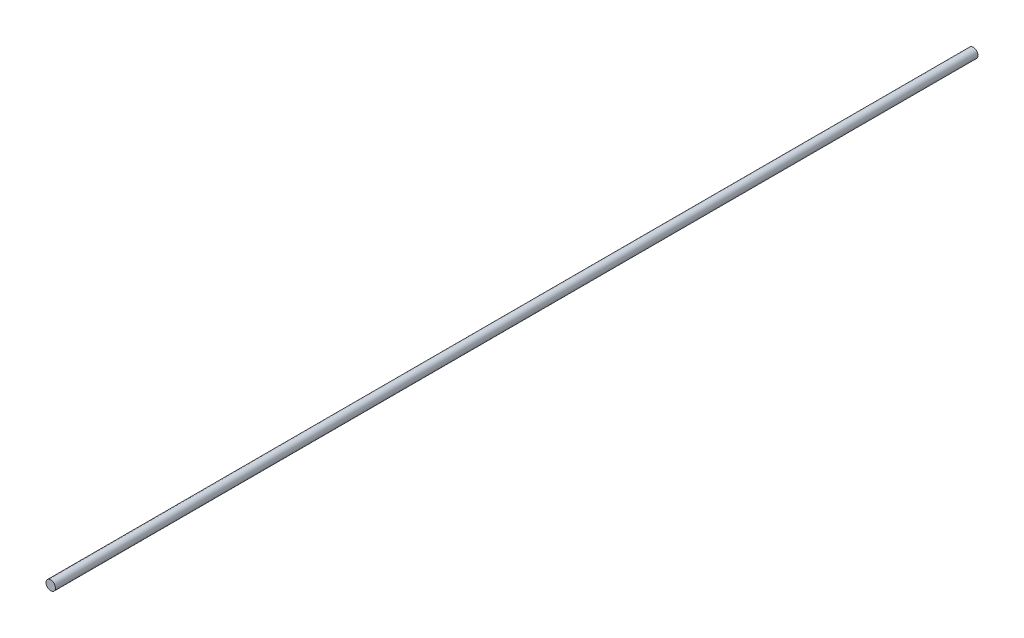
SolidWorks part; units mm, degrees
ref_plane "Front Plane" through (0, 0, 0) normal (0, 0, 1) x (1, 0, 0)
ref_plane "Top Plane" through (0, 0, 0) normal (0, 1, 0) x (1, 0, 0)
ref_plane "Right Plane" through (0, 0, 0) normal (1, 0, 0) x (0, 0, -1)
sketch "Sketch1" plane through (0, 0, 0) normal (0, 0, 1) x (1, 0, 0)
  circle A0 centre (0, 0) radius 30
  dimension "D1" = 60
extrude "Boss-Extrude1" add sketch "Sketch1" against normal blind 5850
